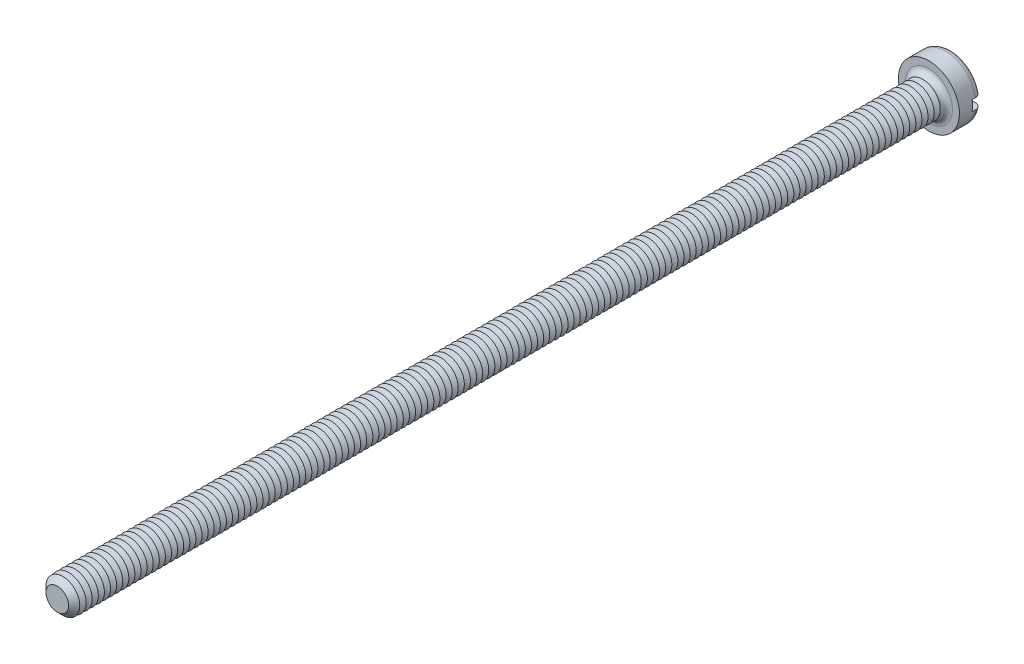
SolidWorks part; units mm, degrees
ref_plane "Front Plane" through (0, 0, 0) normal (0, 0, 1) x (1, 0, 0)
ref_plane "Top Plane" through (0, 0, 0) normal (0, 1, 0) x (1, 0, 0)
ref_plane "Right Plane" through (0, 0, 0) normal (1, 0, 0) x (0, 0, -1)
sketch "Sketch3" plane through (0, 0, 0) normal (0, 0, 1) x (1, 0, 0)
  circle A0 centre (0, 0) radius 3.5
  dimension "D1" = 7
extrude "Boss-Extrude2" add sketch "Sketch3" against normal blind 2.6
sketch "Sketch4" plane through (0, 0, 0) normal (0, 0, 1) x (1, 0, 0)
  circle A0 centre (0, 0) radius 2
  dimension "D1" = 4
extrude "Boss-Extrude3" add sketch "Sketch4" along normal blind 100
fillet "Fillet1" radius 0.7 2 edges at (3.5, 0, -2.6) (2, 0, 0)
chamfer "Chamfer1" distance 0.7 angle 45 1 edges at (2, 0, 100)
sketch "Sketch5" plane through (0, 0, 0) normal (1, 0, 0) x (0, 0, -1)
  line L0 (1.6944, 0) -> (-7.6738, 0) construction
sketch "Sketch6" plane through (0, 0, 0) normal (1, 0, 0) x (0, 0, -1)
  line L0 (-0.7, 2) -> (-1.05, 1.3938)
  line L1 (-1.05, 1.3938) -> (-1.4, 2)
  line L2 (-0.7, 2) -> (-99.3, 2) construction
  line L3 (-1.4, 2) -> (-0.7, 2)
  dimension "D1" = 0.7
revolve "Cut-Revolve1" cut sketch "Sketch6" angle 360 about L0
pattern_linear "LPattern1" count 141 spacing 0.7 along (0, 0, 1) of "Cut-Revolve1"
sketch "Sketch8" plane through (0, 0, -2.6) normal (0, 0, -1) x (-1, 0, 0)
  line L1 (3.5, -0.6) -> (-3.5, -0.6)
  line L2 (3.5, -0.6) -> (3.5, 0.6)
  line L3 (3.5, 0.6) -> (-3.5, 0.6)
  line L4 (-3.5, -0.6) -> (-3.5, 0.6)
  line L5 (3.5, -0.6) -> (-3.5, 0.6) construction
  line L6 (3.5, 0.6) -> (-3.5, -0.6) construction
  point P0 (0, 0)
  dimension "D1" = 7
  dimension "D2" = 1.2
extrude "Cut-Extrude1" cut sketch "Sketch8" against normal blind 1.1
